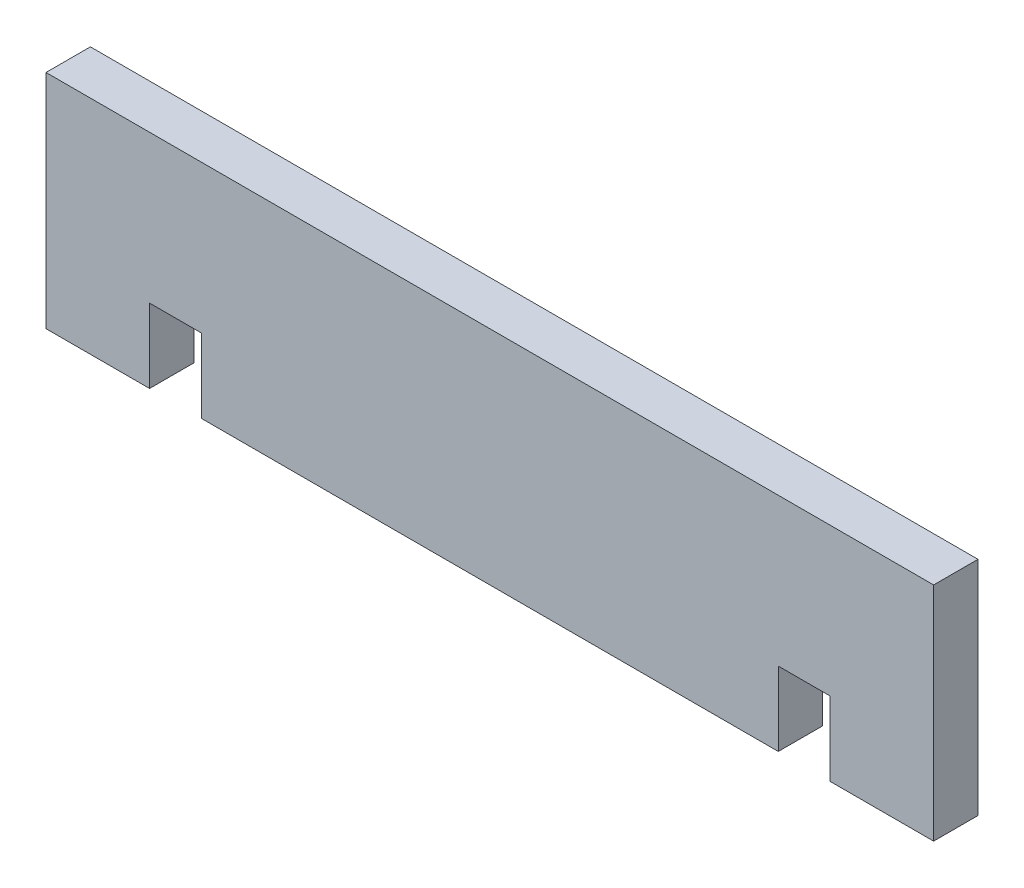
SolidWorks part; units mm, degrees
ref_plane "Plan de face" through (0, 0, 0) normal (0, 0, 1) x (1, 0, 0)
ref_plane "Plan de dessus" through (0, 0, 0) normal (0, 1, 0) x (1, 0, 0)
ref_plane "Plan de droite" through (0, 0, 0) normal (1, 0, 0) x (0, 0, -1)
sketch "Esquisse1" plane through (0, 0, 0) normal (0, 0, 1) x (1, 0, 0)
  line L1 (0, 0) -> (60, 0)
  line L2 (0, 0) -> (0, 15)
  line L3 (0, 15) -> (60, 15)
  line L4 (60, 0) -> (60, 15)
  dimension "D1" = 60
  dimension "D2" = 15
extrude "Extrusion1" add sketch "Esquisse1" along normal blind 3
sketch "Esquisse2" plane through (0, 0, 3) normal (0, 0, 1) x (1, 0, 0)
  line L0 (0, 0) -> (60, 0) construction
  line L1 (7, 0) -> (10.5, 0)
  line L2 (7, 0) -> (7, 5)
  line L3 (7, 5) -> (10.5, 5)
  line L4 (10.5, 0) -> (10.5, 5)
  line L6 (49.5, 0) -> (53, 0)
  line L7 (49.5, 0) -> (49.5, 5)
  line L8 (49.5, 5) -> (53, 5)
  line L9 (53, 0) -> (53, 5)
  dimension "D1" = 3.5
  dimension "D2" = 3.5
  dimension "D3" = 7
  dimension "D4" = 7
  dimension "D5" = 5
  dimension "D6" = 5
extrude "Enlèv. mat.-Extru.1" cut sketch "Esquisse2" against normal blind 3
